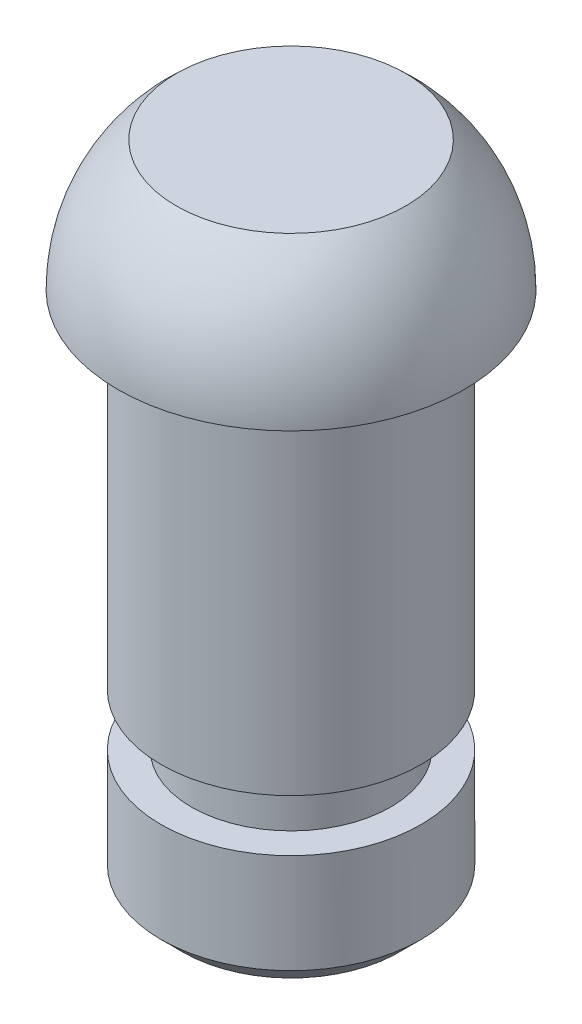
SolidWorks part; units mm, degrees
ref_plane "Front Plane" through (0, 0, 0) normal (0, 0, 1) x (1, 0, 0)
ref_plane "Top Plane" through (0, 0, 0) normal (0, 1, 0) x (1, 0, 0)
ref_plane "Right Plane" through (0, 0, 0) normal (1, 0, 0) x (0, 0, -1)
sketch "Sketch1" plane through (0, 0, 0) normal (0, 0, 1) x (1, 0, 0)
  line L0 (0, 0) -> (0, -1091.448) construction
  line L1 (0, 0) -> (1091.448, 0) construction
  line L3 (-1.325, 2.7669) -> (0, 2.7669)
  line L4 (-2, 1.2688) -> (-1.5, 1.2688)
  line L5 (-1.5, 1.2688) -> (-1.5, -2.7312)
  line L6 (-1.5, -2.7312) -> (-1.15, -2.7312)
  line L7 (-1.15, -2.7312) -> (-1.15, -3.3312)
  line L8 (-1.15, -3.3312) -> (-1.5, -3.3312)
  line L9 (-1.5, -3.3312) -> (-1.5, -4.7312)
  line L10 (-1.5, -4.7312) -> (0, -4.7312)
  line L11 (0, 2.7669) -> (0, -4.7312)
  arc A0 (-1.325, 2.7669) -> (-2, 1.2688) centre (0, 1.2688) ccw
  dimension "D6" = 1.5
  dimension "D1" = 1.5
  dimension "D2" = 4
  dimension "D3" = 0.6
  dimension "D4" = 1.4
  dimension "D5" = 2.65
  dimension "D7" = 1.15
  dimension "D9" = 1.4981
revolve "Revolve1" add sketch "Sketch1" angle 360 about L0
chamfer "Chamfer1" distance 0.25 angle 45 1 edges at (0, -4.7312, 1.5)
